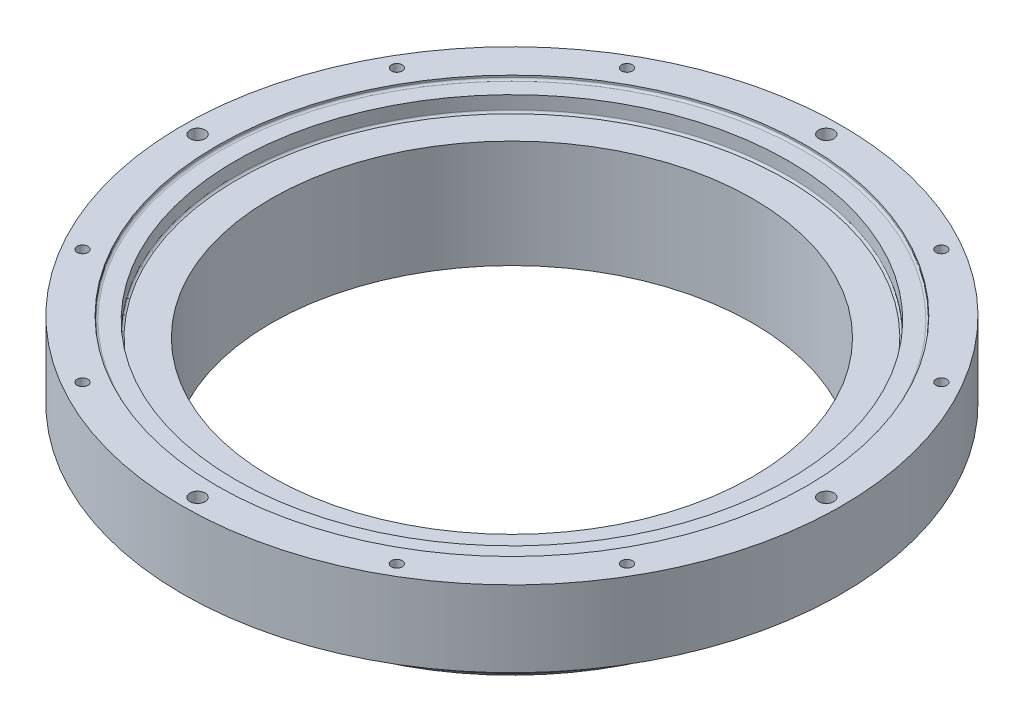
SolidWorks part; units mm, degrees
ref_plane "Front Plane" through (0, 0, 0) normal (0, 0, 1) x (1, 0, 0)
ref_plane "Top Plane" through (0, 0, 0) normal (0, 1, 0) x (1, 0, 0)
ref_plane "Right Plane" through (0, 0, 0) normal (1, 0, 0) x (0, 0, -1)
sketch "Sketch1" plane through (0, 0, 0) normal (0, 0, 1) x (1, 0, 0)
  line L0 (-60.325, -12.7) -> (-60.325, 14.3006)
  line L1 (-60.325, 14.3006) -> (-69.215, 14.3006)
  line L2 (-69.215, 14.3006) -> (-69.215, 18.0848)
  line L3 (-69.215, 18.0848) -> (-73.8378, 18.0848)
  line L4 (-73.8378, 18.0848) -> (-73.8378, 19.05)
  line L7 (-73.8378, 19.05) -> (-82.55, 19.05)
  line L8 (-82.55, 19.05) -> (-82.55, 0)
  line L25 (-82.55, 0) -> (-73.6727, 0)
  line L26 (-73.6727, 0) -> (-73.6727, 2.5654)
  line L27 (-73.6727, 2.5654) -> (-69.1769, 2.5654)
  line L28 (-69.1769, 2.5654) -> (-69.1769, 0)
  line L29 (-69.1769, 0) -> (-66.6369, 0)
  line L30 (-66.6369, 0) -> (-66.6369, -4.698)
  line L31 (-66.6369, -4.698) -> (-63.8683, -4.698)
  line L32 (-63.8683, -4.698) -> (-63.8683, -9.27)
  line L33 (-63.8683, -9.27) -> (-66.6369, -9.27)
  line L34 (-66.6369, -9.27) -> (-66.6369, -12.7)
  line L35 (-66.6369, -12.7) -> (-60.325, -12.7)
  point P7 (-78.1114, 0)
  point P8 (-73.8378, 18.5674)
  dimension "D1" = 60.325
  dimension "D2" = 19.05
  dimension "D3" = 4.6228
  dimension "D4" = 2.5654
  dimension "D5" = 4.4958
  dimension "D6" = 2.7686
  dimension "D7" = 66.6369
  dimension "D8" = 4.572
  dimension "D9" = 2.54
  dimension "D10" = 8.89
  dimension "D11" = 3.7842
  dimension "D12" = 4.698
  dimension "D13" = 0.9652
  dimension "D14" = 31.75
  dimension "D15" = 82.55
  dimension "D16" = 12.7
ref_axis "Axis1" through (0, 26.1975, 0) along (0, -1, 0)
revolve "Revolve1" add sketch "Sketch1" angle 360 about axis through (0, 26.1975, 0) along (0, -1, 0)
chamfer "Chamfer1" distance 1.27 angle 45 1 edges at (0, -12.7, 66.6369)
hole_wizard "#6 Clearance Hole1" positions "Sketch2" profile "Sketch4" hole size "#6" standard "ANSI Inch"
sketch "Sketch2" plane through (0, 19.05, 0) normal (0, 1, 0) x (1, 0, 0)
  circle A0 centre (0, 0) radius 78.74
  point P5 (0, 78.74)
  dimension "D1" = 157.48
sketch "Sketch4" plane through (0, 19.05, -78.74) normal (1, 0, 0) x (0, 0, 1)
  line L0 (0, 0) -> (0, 31.75)
  line L1 (0, 31.75) -> (1.8986, 31.75)
  line L2 (1.8986, 31.75) -> (1.8986, 0)
  line L5 (1.8986, 0) -> (0, 0)
  line L11 (0, -6.35) -> (0, 107.95) construction
  dimension "Thru Hole Dia." = 3.7973
  dimension "Thru Hole Depth" = 31.75
hole_wizard "#6-32 Tapped Hole1" positions "Sketch5" profile "Sketch7" tap size "#6-32" standard "ANSI Inch"
sketch "Sketch5" plane through (0, 19.05, 0) normal (0, 1, 0) x (1, 0, 0)
  line L0 (0, 78.74) -> (0, 0)
  line L1 (0, 0) -> (39.37, 68.1908)
  circle A0 centre (0, 0) radius 78.74
  point P6 (39.37, 68.1908)
  dimension "D1" = 157.48
  dimension "D2" = 30
sketch "Sketch7" plane through (39.37, 19.05, -68.1908) normal (1, 0, 0) x (0, 0, 1)
  line L0 (0, 0) -> (0, 31.75)
  line L1 (0, 31.75) -> (1.3525, 31.75)
  line L2 (1.3525, 31.75) -> (1.3525, 0)
  line L5 (1.3525, 0) -> (0, 0)
  line L11 (0, -6.35) -> (0, 107.95) construction
  dimension "Thru Tap Drill Dia." = 2.7051
  dimension "Thru Tap Drill Depth" = 31.75
hole_wizard "#6-32 Tapped Hole2" positions "Sketch8" profile "Sketch9" tap size "#6-32" standard "ANSI Inch"
sketch "Sketch8" plane through (0, 19.05, 0) normal (0, 1, 0) x (1, 0, 0)
  line L0 (0, 78.74) -> (0, 0)
  line L1 (0, 0) -> (68.1908, 39.37)
  circle A0 centre (0, 0) radius 78.74
  point P0 (68.1908, 39.37)
  dimension "D1" = 157.48
  dimension "D2" = 60
sketch "Sketch9" plane through (68.1908, 19.05, -39.37) normal (1, 0, 0) x (0, 0, 1)
  line L0 (0, 0) -> (0, 31.75)
  line L1 (0, 31.75) -> (1.3525, 31.75)
  line L2 (1.3525, 31.75) -> (1.3525, 0)
  line L5 (1.3525, 0) -> (0, 0)
  line L11 (0, -6.35) -> (0, 107.95) construction
  dimension "Thru Tap Drill Dia." = 2.7051
  dimension "Thru Tap Drill Depth" = 31.75
sketch "Sketch13" plane through (0, 0, 0) normal (0, -1, 0) x (1, 0, 0)
  circle A0 centre (39.37, -68.1908) radius 1.905
  circle A1 centre (68.1908, -39.37) radius 1.905
  dimension "D1" = 3.81
  dimension "D2" = 3.81
extrude "Cut-Extrude3" cut sketch "Sketch13" against normal blind 12.7
pattern_circular "CirPattern1" count 4 over 360 about axis through (0, 0, 0) along (0, 1, 0) of "#6-32 Tapped Hole2", "#6-32 Tapped Hole1", "#6 Clearance Hole1", "Cut-Extrude3"
fillet "Fillet1" radius 0.508 5 edges at (0, -9.27, 63.8683) (0, 2.5654, 73.6727) (0, 2.5654, 69.1769) (0, -4.698, 63.8683) (0, 0, 66.6369)
fillet "Fillet2" radius 0.508 2 edges at (0, 18.0848, 73.8378) (0, 14.3006, 69.215)
sketch "Sketch10" plane through (0, 0, 0) normal (0, 0, 1) x (1, 0, 0)
  line L1 (-104.8296, 78.7301) -> (104.8296, 78.7301)
  line L2 (-104.8296, 78.7301) -> (-104.8296, -47.9887)
  line L3 (-104.8296, -47.9887) -> (104.8296, -47.9887)
  line L4 (104.8296, 78.7301) -> (104.8296, -47.9887)
  line L5 (-104.8296, 78.7301) -> (104.8296, -47.9887) construction
  line L6 (-104.8296, -47.9887) -> (104.8296, 78.7301) construction
  point P0 (0, 15.3707)
extrude "Cut-Extrude1" [suppressed] cut sketch "Sketch10" against normal through all
sketch "Sketch11" plane through (0, 0, 0) normal (-1, 0, 0) x (0, 1, 0)
  line L1 (-234.127, -93.378) -> (138.3302, -93.378)
  line L2 (-234.127, -93.378) -> (-234.127, 95.9608)
  line L3 (-234.127, 95.9608) -> (138.3302, 95.9608)
  line L4 (138.3302, -93.378) -> (138.3302, 95.9608)
  line L5 (-234.127, -93.378) -> (138.3302, 95.9608) construction
  line L6 (-234.127, 95.9608) -> (138.3302, -93.378) construction
  point P0 (-47.8984, 1.2914)
extrude "Cut-Extrude2" [suppressed] cut sketch "Sketch11" against normal through all
sketch "Sketch12" plane through (0, 19.05, 0) normal (0, 1, 0) x (1, 0, 0)
  circle A0 centre (-78.74, 0) radius 3.3274
  dimension "D1" = 6.6548
equation "\"Air Weight\"= \"SW-Mass\""
equation "\"Buoyancy\"= \"SW-Volume\" * ( \"SW-Density\" - .037062 )"
